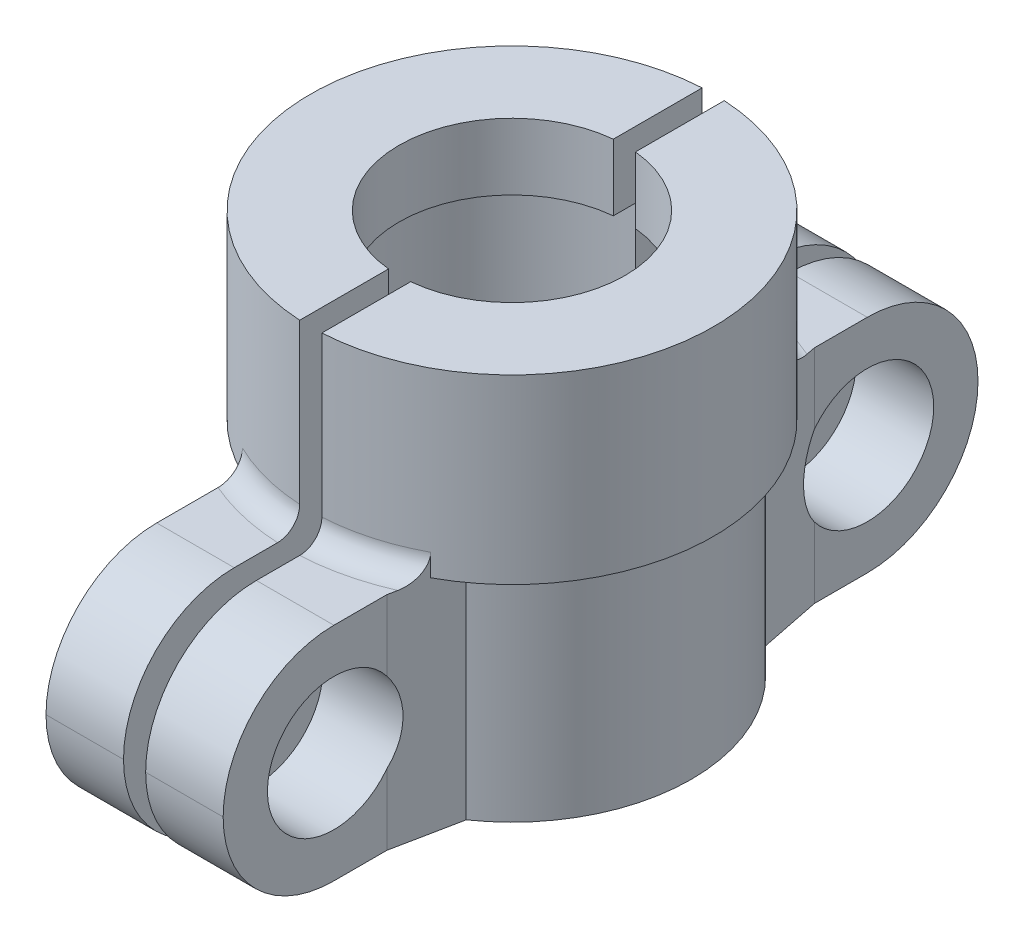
SolidWorks part; units mm, degrees
ref_plane "Front Plane" through (0, 0, 0) normal (0, 0, 1) x (1, 0, 0)
ref_plane "Top Plane" through (0, 0, 0) normal (0, 1, 0) x (1, 0, 0)
ref_plane "Right Plane" through (0, 0, 0) normal (1, 0, 0) x (0, 0, -1)
sketch "Sketch1" plane through (0, 0, 0) normal (0, 1, 0) x (1, 0, 0)
  circle A0 centre (0, 0) radius 2.55
  circle A1 centre (0, 0) radius 4.05
  dimension "D1" = 5.1
  dimension "D2" = 1.5
extrude "Boss-Extrude1" add sketch "Sketch1" along normal blind 5
sketch "Sketch2" plane through (0, 5, 0) normal (0, 1, 0) x (1, 0, 0)
  circle A0 centre (0, 0) radius 3.05
  circle A2 centre (0, 0) radius 4.55
  dimension "D1" = 6.1
  dimension "D2" = 1.5
extrude "Boss-Extrude2" add sketch "Sketch2" along normal blind 4.1
sketch "Sketch3" plane through (0, 9.1, 0) normal (0, 1, 0) x (1, 0, 0)
  circle A1 centre (0, 0) radius 2.55
  circle A2 centre (0, 0) radius 3.05 construction
  circle A3 centre (0, 0) radius 3.05
  dimension "D1" = 0.5
extrude "Boss-Extrude3" add sketch "Sketch3" against normal blind 1.5
sketch "Sketch4" plane through (0, 0, 0) normal (0, 1, 0) x (1, 0, 0)
  line L0 (0, 12.6112) -> (0, -9.8515) construction
  line L1 (2, 3.5217) -> (-2, 3.5217)
  line L2 (2, 3.5217) -> (2, 8.5217)
  line L3 (2, 8.5217) -> (-2, 8.5217)
  line L4 (-2, 3.5217) -> (-2, 8.5217)
  circle A0 centre (0, 0) radius 4.05 construction
  point P8 (0, 8.5217)
  dimension "D1" = 4
  dimension "D2" = 5
extrude "Boss-Extrude4" add sketch "Sketch4" along normal up to surface (5 mm away)
sketch "Sketch5" plane through (2, 0, 0) normal (1, 0, 0) x (0, 0, -1)
  line L0 (6.0217, 0) -> (6.0217, 5) construction
  line L1 (3.5217, 0) -> (8.5217, 0) construction
  line L2 (4.0869, 5) -> (8.5217, 5) construction
  line L3 (3.5217, 2.5) -> (8.5217, 2.5) construction
  line L4 (3.5217, 5) -> (3.5217, 0) construction
  line L5 (8.5217, 5) -> (8.5217, 0) construction
  circle A0 centre (6.0217, 2.5) radius 1.5
  point P8 (6.0217, 2.5)
  dimension "D1" = 3
extrude "Cut-Extrude1" cut sketch "Sketch5" against normal blind 10
fillet "Fillet1" radius 0.5 1 edges at (0, 5, -4.55)
fillet "Fillet2" radius 2.5 2 edges at (0, 5, -8.5217) (0, 0, -8.5217)
chamfer "Chamfer1" distance 0.5 angle 45 2 edges at (-2, 2.5, -3.5217) (2, 2.5, -3.5217)
mirror "Mirror1" about plane through (0, 0, 0) normal (0, 0, 1)
sketch "Sketch6" plane through (0, 0, 0) normal (0, 1, 0) x (1, 0, 0)
  line L0 (-2, 8.5217) -> (2, 8.5217) construction
  line L1 (-0.25, 8.5217) -> (0.25, 8.5217)
  line L2 (-0.25, 8.5217) -> (-0.25, -8.5217)
  line L3 (-0.25, -8.5217) -> (0.25, -8.5217)
  line L4 (0.25, 8.5217) -> (0.25, -8.5217)
  line L5 (-2, -8.5217) -> (2, -8.5217) construction
  point P8 (0, 8.5217)
  dimension "D1" = 0.5
extrude "Cut-Extrude2" cut sketch "Sketch6" against normal through all both and the other way through all
